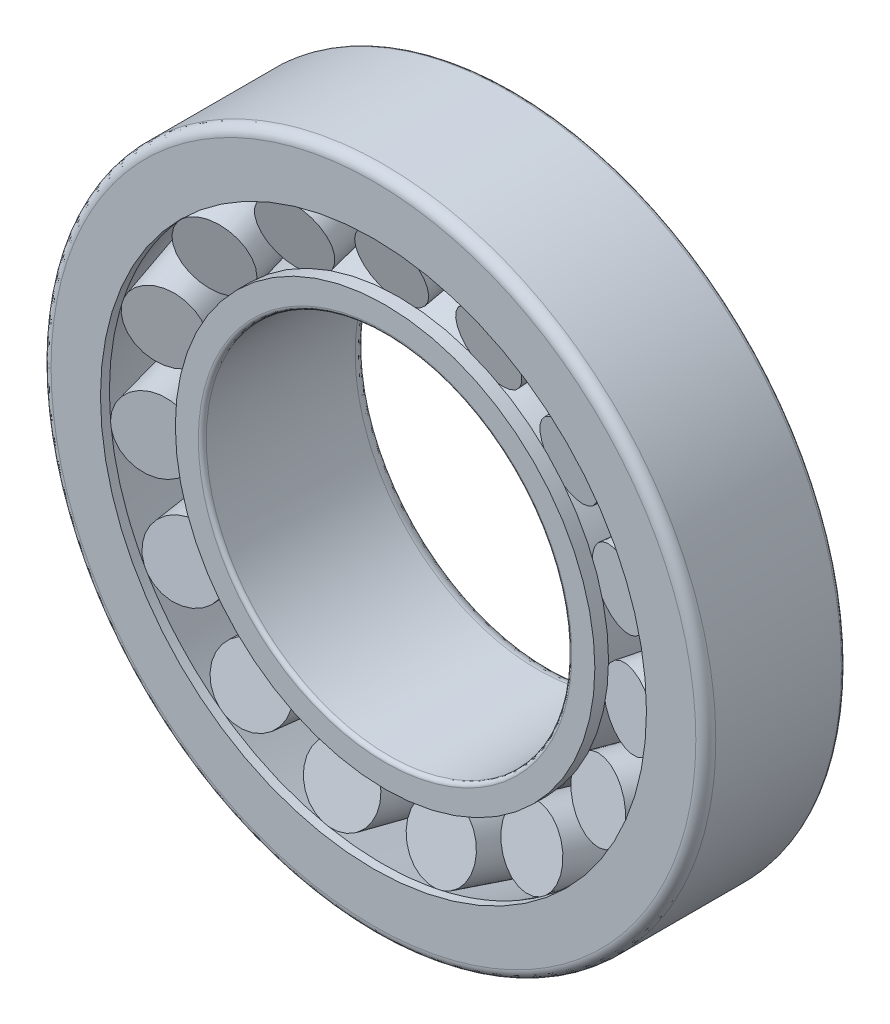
SolidWorks part; units mm, degrees
ref_plane "Front Plane" through (0, 0, 0) normal (0, 0, 1) x (1, 0, 0)
ref_plane "Top Plane" through (0, 0, 0) normal (0, 1, 0) x (1, 0, 0)
ref_plane "Right Plane" through (0, 0, 0) normal (1, 0, 0) x (0, 0, -1)
other "Configuration Table"
sketch "BaseSke" plane through (0, 0, 0) normal (1, 0, 0) x (0, 0, -1)
  line L0 (-47.2296, 0) -> (24.6132, 0) construction
  line L2 (0, 129.5214) -> (0, -86.3012) construction
  line L3 (6.7886, 44.1906) -> (-33.5386, 33.3094) construction
  line L4 (-26.75, 50) -> (-5.75, 50) construction
  line L5 (-25, 27.5) -> (0, 27.5) construction
  line L6 (-13.375, 38.75) -> (-20.4266, 64.8845) construction
  line L7 (-25.4125, 41.0943) -> (-7.0875, 46.5572)
  line L8 (-7.0875, 46.5572) -> (-5.5506, 40.8612)
  line L9 (-5.5506, 40.8612) -> (-24.006, 35.8815)
  line L10 (-24.006, 35.8815) -> (-25.4125, 41.0943)
  line L11 (-26.75, 50) -> (-26.75, 41.075) construction
  line L12 (-25.4073, 41.075) -> (-5.75, 46.9351) construction
  line L13 (-5.75, 50) -> (-5.75, 46.9351) construction
  line L14 (-25.4073, 41.075) -> (-26.75, 41.075) construction
  line L15 (-22.5995, 30.6688) -> (-4.0137, 35.1651) construction
  line L16 (-25, 27.5) -> (-25, 31.5604) construction
  line L17 (-25, 31.5604) -> (-22.9436, 31.5604) construction
  line L18 (0, 36.0568) -> (0, 27.5) construction
  line L19 (-22.9436, 31.5604) -> (-22.7097, 30.6935) construction
  line L20 (-22.7097, 30.6935) -> (-3.9295, 35.237) construction
  line L21 (-3.9295, 35.237) -> (-4.1507, 36.0568) construction
  line L22 (-4.1507, 36.0568) -> (0, 36.0568) construction
revolve "Roller" add sketch "BaseSke" angle 360 about L3
sketch "OuterRaceSke" plane through (0, 0, 0) normal (1, 0, 0) x (0, 0, -1)
  line L0 (-25.4073, 41.075) -> (-26.75, 41.075) construction
  line L1 (-25.4073, 41.075) -> (-5.75, 46.9351) construction
  line L2 (-5.75, 50) -> (-5.75, 46.9351) construction
  line L3 (-26.75, 50) -> (-5.75, 50) construction
  line L4 (-26.75, 50) -> (-26.75, 41.075) construction
  line L5 (-25.4073, 41.075) -> (-26.75, 41.075)
  line L6 (-25.4073, 41.075) -> (-5.75, 46.9351)
  line L7 (-5.75, 50) -> (-5.75, 46.9351)
  line L8 (-26.75, 50) -> (-5.75, 50)
  line L9 (-26.75, 50) -> (-26.75, 41.075)
  line L10 (-60.3939, 0) -> (35.9926, 0) construction
revolve "OuterRace" add sketch "OuterRaceSke" angle 360 about L10
sketch "InnerRaceSke" plane through (0, 0, 0) normal (1, 0, 0) x (0, 0, -1)
  line L0 (-25, 27.5) -> (0, 27.5) construction
  line L1 (-25, 27.5) -> (-25, 31.5604) construction
  line L2 (-25, 31.5604) -> (-22.9436, 31.5604) construction
  line L3 (-22.9436, 31.5604) -> (-22.7097, 30.6935) construction
  line L4 (-22.7097, 30.6935) -> (-3.9295, 35.237) construction
  line L5 (-3.9295, 35.237) -> (-4.1507, 36.0568) construction
  line L6 (-4.1507, 36.0568) -> (0, 36.0568) construction
  line L7 (0, 36.0568) -> (0, 27.5) construction
  line L8 (-25, 27.5) -> (0, 27.5)
  line L9 (-25, 27.5) -> (-25, 31.5604)
  line L10 (-25, 31.5604) -> (-22.9436, 31.5604)
  line L11 (-22.9436, 31.5604) -> (-22.7097, 30.6935)
  line L12 (-22.7097, 30.6935) -> (-3.9295, 35.237)
  line L13 (-3.9295, 35.237) -> (-4.1507, 36.0568)
  line L14 (-4.1507, 36.0568) -> (0, 36.0568)
  line L15 (0, 36.0568) -> (0, 27.5)
  line L16 (-58.1022, 0) -> (39.538, 0) construction
revolve "InnerRace" add sketch "InnerRaceSke" angle 360 about L16
fillet "Fillet1" radius 0.6 2 edges at (50, 0, 5.75) (27.5, 0, 25)
fillet "InnerFillet" radius 2 1 edges at (27.5, 0, 0)
fillet "OuterFillet" radius 1.5 1 edges at (50, 0, 26.75)
pattern_circular "CirPatternBall" count 15 over 360 about axis through (0, 0, 0) along (0, 0, 1) of "Roller"
sketch "Sketch4" plane through (0, 0, 0) normal (1, 0, 0) x (0, 0, -1)
  line L0 (-25.4125, 41.0943) -> (-7.0875, 46.5572)
  line L1 (-7.0875, 46.5572) -> (-4.0137, 35.1651)
  line L2 (-4.0137, 35.1651) -> (-22.5995, 30.6688)
  line L3 (-22.5995, 30.6688) -> (-25.4125, 41.0943)
  line L4 (-40.3293, 0) -> (19.5574, 0) construction
revolve "Simplified" [suppressed] add sketch "Sketch4" angle 360 about L4
equation "\"D2@BaseSke\" = \"Bearing_Thickness@BaseSke\"/2"
equation "\"D3@BaseSke\" =  ( \"Bearing_Outside_Diameter@BaseSke\" + \"Bearing_Inside_Diameter@BaseSke\" )  / 2"
equation "\"Roller_diameter@BaseSke\" = \"D3@BaseSke\"*1.06"
equation "\"D4@BaseSke\" = \"Bearing_Thickness@BaseSke\"/20"
equation "\"D5@BaseSke\" = \"Bearing_Thickness@BaseSke\" / 20"
equation "\"D8@BaseSke\" = \"Bearing_Thickness@BaseSke\"/30"
equation "\"D11@BaseSke\" = \"D8@BaseSke\""
equation "\"D1@CirPatternBall\" = int(  \"D3@BaseSke\" *  pi  /  ( \"Bearing_Outside_Diameter@BaseSke\" - \"Bearing_Inside_Diameter@BaseSke\" )  * 2.8 ) "
